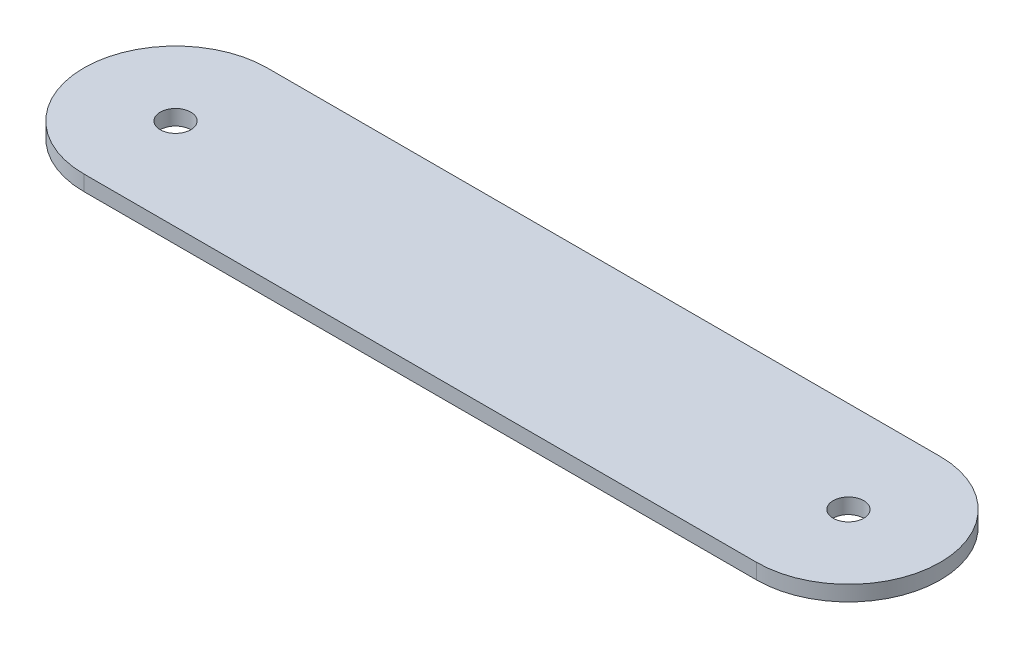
SolidWorks part; units mm, degrees
ref_plane "Front Plane" through (0, 0, 0) normal (0, 0, 1) x (1, 0, 0)
ref_plane "Top Plane" through (0, 0, 0) normal (0, 1, 0) x (1, 0, 0)
ref_plane "Right Plane" through (0, 0, 0) normal (1, 0, 0) x (0, 0, -1)
sketch "Sketch2" plane through (0, 0, 0) normal (0, 1, 0) x (1, 0, 0)
  line L0 (-22, 0) -> (22, 0) construction
  line L1 (-22, 6) -> (22, 6)
  line L2 (-22, -6) -> (22, -6)
  arc A0 (-22, 6) -> (-22, -6) centre (-22, 0) ccw
  arc A1 (22, -6) -> (22, 6) centre (22, 0) ccw
  circle A2 centre (-22, 0) radius 1
  circle A3 centre (22, 0) radius 1
  point P2 (0, 0)
  point P12 (-23, 0)
  point P13 (21, 0)
  dimension "D2" = 6
  dimension "D3" = 2
  dimension "D4" = 2
  dimension "D1" = 44
extrude "Boss-Extrude1" add sketch "Sketch2" along normal blind 1
